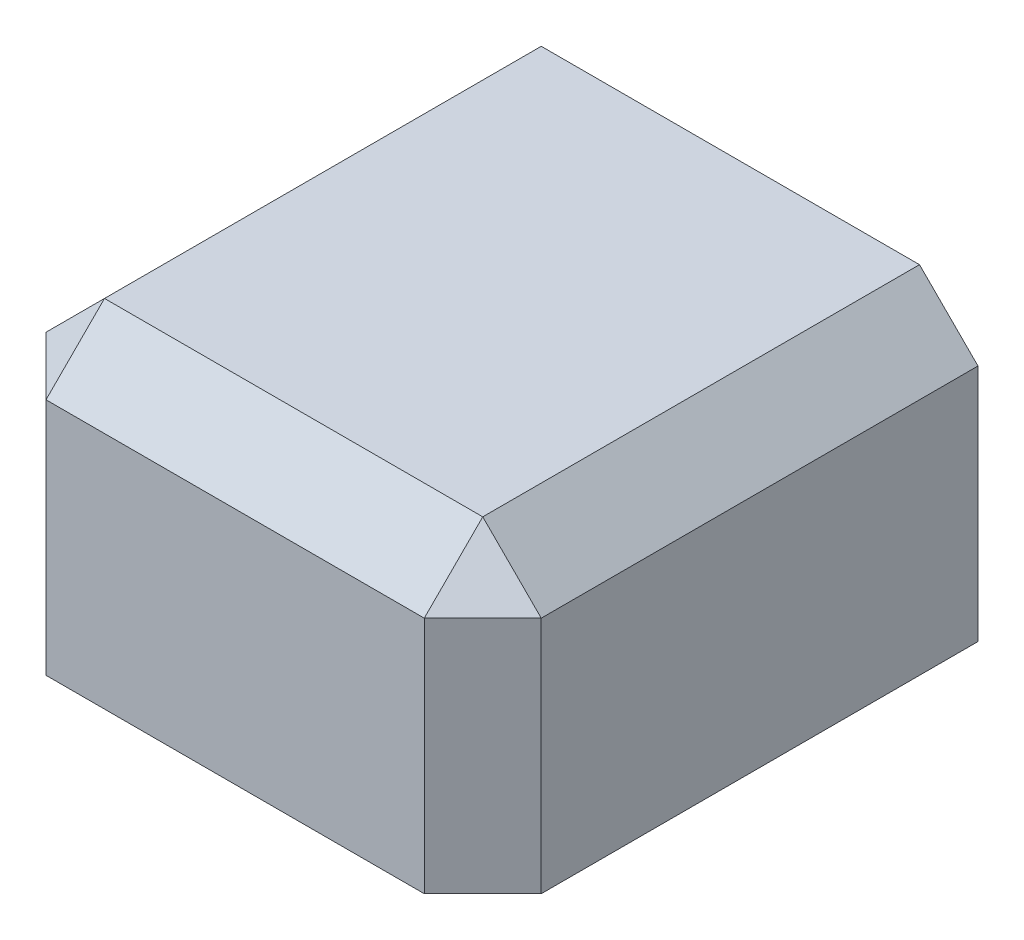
SolidWorks part; units mm, degrees
ref_plane "Front Plane" through (0, 0, 0) normal (0, 0, 1) x (1, 0, 0)
ref_plane "Top Plane" through (0, 0, 0) normal (0, 1, 0) x (1, 0, 0)
ref_plane "Right Plane" through (0, 0, 0) normal (1, 0, 0) x (0, 0, -1)
sketch "Sketch1" plane through (0, 0, 0) normal (0, 1, 0) x (1, 0, 0)
  line L1 (-63.5, 63.5) -> (63.5, 63.5)
  line L2 (-63.5, 63.5) -> (-63.5, -63.5)
  line L3 (-63.5, -63.5) -> (63.5, -63.5)
  line L4 (63.5, 63.5) -> (63.5, -63.5)
  line L5 (-63.5, 63.5) -> (63.5, -63.5) construction
  line L6 (-63.5, -63.5) -> (63.5, 63.5) construction
  point P0 (0, 0)
  dimension "D1" = 127
  dimension "D2" = 127
extrude "Boss-Extrude1" add sketch "Sketch1" along normal blind 76.2
chamfer "Chamfer1" distance 15 angle 45 5 edges at (-63.5, 38.1, 63.5) (-63.5, 76.2, 0) (0, 76.2, 63.5) (63.5, 38.1, 63.5) (63.5, 76.2, 0)
other "Cavity1"
other "gating-0^die_demo-a2<1>@die_demo-a2"
